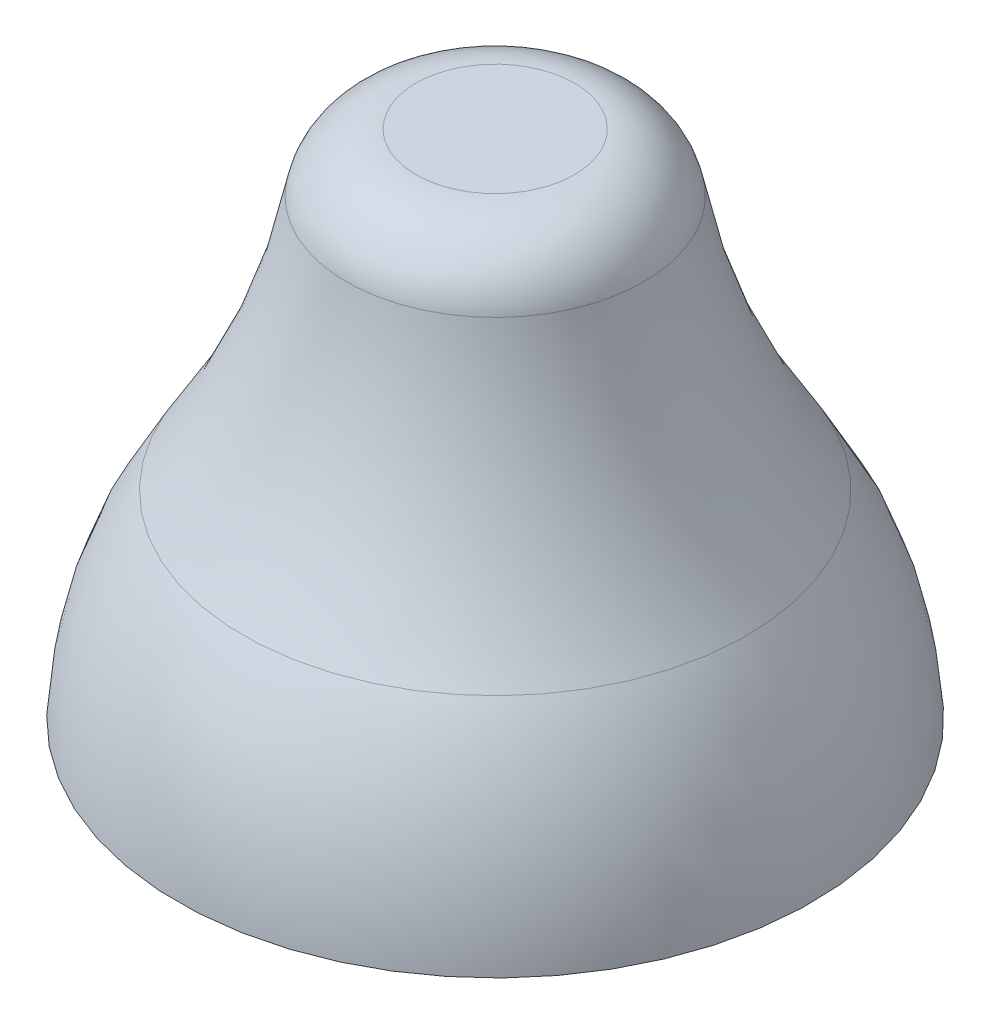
SolidWorks part; units mm, degrees
ref_plane "Front Plane" through (0, 0, 0) normal (0, 0, 1) x (1, 0, 0)
ref_plane "Top Plane" through (0, 0, 0) normal (0, 1, 0) x (1, 0, 0)
ref_plane "Right Plane" through (0, 0, 0) normal (1, 0, 0) x (0, 0, -1)
sketch "Sketch1" plane through (0, 0, 0) normal (0, 0, 1) x (1, 0, 0)
  line L0 (0, 0) -> (0.9, 0)
  line L1 (0, 0) -> (0, 1.45)
  line L2 (0, 1.45) -> (0.225, 1.45)
  arc A0 (0.9, 0) -> (0.714, 0.562) centre (-0.1988, -0.0519) ccw
  arc A1 (0.714, 0.562) -> (0.4219, 1.285) centre (2.2921, 1.6201) cw
  arc A2 (0.4219, 1.285) -> (0.225, 1.45) centre (0.225, 1.25) ccw
  dimension "D3" = 0.2
  dimension "D4" = 1.1
  dimension "D5" = 1.9
  dimension "D1" = 1.45
  dimension "D2" = 0.9
  dimension "D6" = 0.225
  dimension "D7" = 0.2
  dimension "D8" = 0.165
  dimension "D9" = 0.888
  dimension "D10" = 0.714
revolve "Revolve1" add sketch "Sketch1" angle 360 about L1
sketch "Sketch2" plane through (0, 0, 0) normal (0, -1, 0) x (1, 0, 0)
  circle A0 centre (0, 0) radius 0.5
  dimension "D1" = 1
extrude "Cut-Extrude1" cut sketch "Sketch2" against normal blind 0.5
